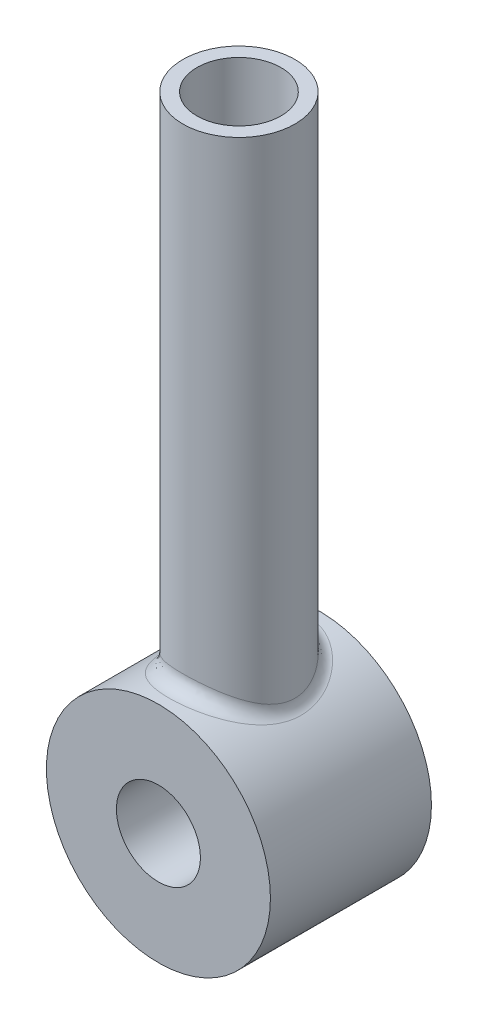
SolidWorks part; units mm, degrees
ref_plane "Face" through (0, 0, 0) normal (0, 0, 1) x (1, 0, 0)
ref_plane "Dessus" through (0, 0, 0) normal (0, 1, 0) x (1, 0, 0)
ref_plane "Droite" through (0, 0, 0) normal (1, 0, 0) x (0, 0, -1)
sketch "Esquisse1" plane through (0, 0, 0) normal (0, 0, 1) x (1, 0, 0)
  circle A0 centre (0, 0) radius 8
  dimension "D1" = 16
extrude "Base-Extrusion" add sketch "Esquisse1" along normal blind 11.5
sketch "Esquisse2" plane through (0, 0, 0) normal (0, 1, 0) x (1, 0, 0)
  line L0 (0, -11.5) -> (0, 0) construction
  line L1 (0, 0) -> (0, -5.75) construction
  line L2 (0, -5.75) -> (0, -11.5) construction
  line L3 (-8, -11.5) -> (8, -11.5) construction
  circle A0 centre (0, -5.75) radius 4
  dimension "D1" = 8
extrude "Boss.-Extru.1" add sketch "Esquisse2" along normal blind 43
sketch "Esquisse3" plane through (0, 0, 11.5) normal (0, 0, 1) x (1, 0, 0)
  circle A0 centre (0, 0) radius 3
  dimension "D1" = 6
extrude "Enlèv. mat.-Extru.1" cut sketch "Esquisse3" against normal through all
fillet "Congé1" radius 1
sketch "Esquisse4" plane through (0, 43, 0) normal (0, 1, 0) x (-1, 0, 0)
  circle A0 centre (0, 5.75) radius 3
  circle A1 centre (0, 5.75) radius 4 construction
  dimension "D1" = 6
extrude "Enlèv. mat.-Extru.2" cut sketch "Esquisse4" against normal blind 10
scale "Echelle1"
